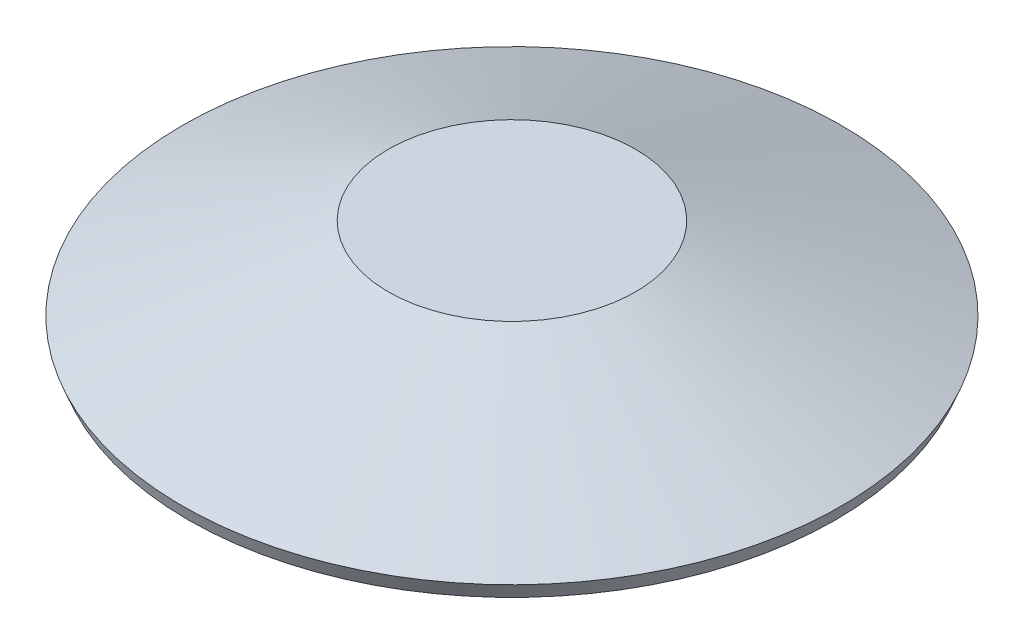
SolidWorks part; units mm, degrees
ref_plane "Front" through (0, 0, 0) normal (0, 0, 1) x (1, 0, 0)
ref_plane "Top" through (0, 0, 0) normal (0, 1, 0) x (1, 0, 0)
ref_plane "Right" through (0, 0, 0) normal (1, 0, 0) x (0, 0, -1)
sketch "Sketch1" plane through (0, 0, 0) normal (0, 0, 1) x (1, 0, 0)
  line L0 (0, -0.1559) -> (0, -2.4624) construction
  line L1 (0, 1.6) -> (0, -3.7)
  line L2 (0, -3.7) -> (1, -3.7)
  line L3 (0, 1.6) -> (3, 1.6)
  line L4 (3, 1.6) -> (8, -0.4)
  line L5 (8, -0.4) -> (7.8514, -0.7714)
  line L6 (7.8514, -0.7714) -> (2.5, 0.5)
  line L7 (2.5, 0.5) -> (2.5, 0)
  line L8 (2.5, 0) -> (1.8669, 0)
  line L9 (1.8669, 0) -> (1.5748, -1.9)
  line L10 (1, -3.7) -> (1, -3.3)
  line L11 (1.5748, -2.3252) -> (2, -2.3252) construction
  line L12 (1, -3.3) -> (1.8331, -2.663)
  arc A1 (2, -2.3252) -> (1.8331, -2.663) centre (1.5748, -2.3252) cw
  arc A2 (2, -2.3252) -> (1.5748, -1.9) centre (1.5748, -2.3252) ccw
  dimension "D2" = 5.3
  dimension "D3" = 2
  dimension "D4" = 0.5
  dimension "D5" = 5
  dimension "D6" = 1.8
  dimension "D7" = 0.4
  dimension "D8" = 4
  dimension "D9" = 6
  dimension "D10" = 0.4
  dimension "D11" = 1.6
  dimension "D12" = 16
  dimension "D13" = 2
  dimension "D14" = 3.7338
  dimension "D15" = 3.1496
revolve "Revolve1" add sketch "Sketch1" angle 360 about L0
